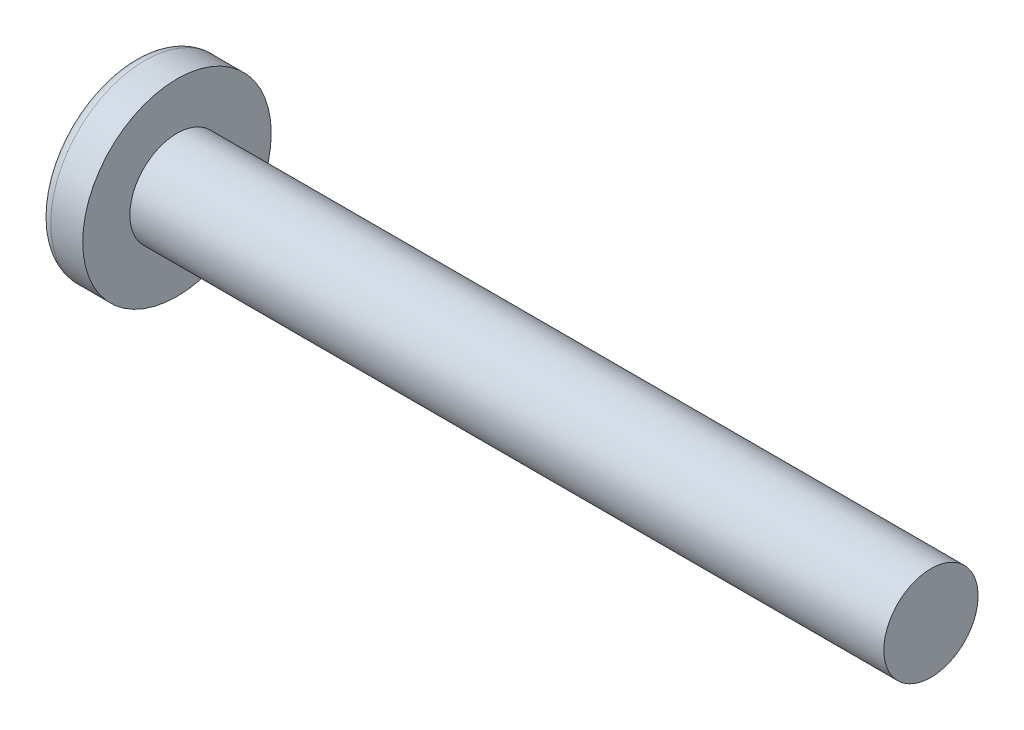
SolidWorks part; units mm, degrees
ref_plane "Plane1" through (0, 0, 0) normal (0, 0, 1) x (1, 0, 0)
ref_plane "Plane2" through (0, 0, 0) normal (0, 1, 0) x (1, 0, 0)
ref_plane "Plane3" through (0, 0, 0) normal (1, 0, 0) x (0, 0, -1)
revolve "Base-Revolve" add sketch "BodySke" angle 360 about L2
sketch "BodySke" plane through (0, 0, 0) normal (0, 0, 1) x (1, 0, 0)
  line L0 (7.5, 5) -> (7.5, 10)
  line L1 (9, 6.35) -> (9, -3.175) construction
  line L2 (-25.4, 0) -> (127, 0) construction
  line L3 (87.5, 0) -> (0, 0)
  line L4 (7.5, 5) -> (87.5, 5)
  line L5 (87.5, 5) -> (87.5, 0)
  line L6 (4.1004, 10) -> (7.5, 10)
  line L7 (7.5, -5) -> (87.5, -5) construction
  line L8 (49.5, 6.35) -> (49.5, -3.175) construction
  arc A0 (3.1356, 9.5135) -> (0, 0) centre (16, 0) ccw
  arc A2 (3.1356, 9.5135) -> (4.1004, 10) centre (4.1004, 8.8) cw
  dimension "Head_fillet_rad" = 1.2
  dimension "Head_crown_rad" = 16
  dimension "Head_ht" = 7.5
  dimension "Diameter" = 10
  dimension "Length" = 80
  dimension "Head_dia" = 20
  dimension "Advance" = 1.5
  dimension "Thread_nom" = 38
sketch "Sketch3" plane through (0, 0, 0) normal (1, 0, 0) x (0, 0, -1)
  line L0 (0.92, -5.09) -> (-0.92, -5.09)
  line L1 (0.92, -5.09) -> (0.92, 5.09)
  line L2 (-0.92, 5.09) -> (0.92, 5.09)
  line L3 (-0.92, 5.09) -> (-0.92, -5.09)
  dimension "D1" = 5.09
  dimension "Cross_dia" = 10.18
  dimension "D2" = 0.92
  dimension "Cross_width" = 1.84
ref_plane "Plane4" through (6.09, 0, 0) normal (1, 0, 0) x (0, 0, -1)
sketch "Sketch4" plane through (6.09, 0, 0) normal (1, 0, 0) x (0, 0, -1)
  line L0 (0.46, -0.46) -> (-0.46, -0.46)
  line L1 (0.46, -0.46) -> (0.46, 0.46)
  line L2 (-0.46, 0.46) -> (0.46, 0.46)
  line L3 (-0.46, 0.46) -> (-0.46, -0.46)
  dimension "D1" = 0.92
  dimension "D2" = 0.92
  dimension "D3" = 0.46
  dimension "D4" = 0.46
loft "Cut-Loft1" cut profiles "Sketch3", "Sketch4"
pattern_circular "CirPattern1" count 2 every 90 about axis through (0, 0, 0) along (1, 0, 0) of "Cut-Loft1"
sketch "ThdSchSke" plane through (0, 0, 0) normal (0, 0, 1) x (1, 0, 0)
  line L0 (49.5, -4.172) -> (48.9202, -5)
  line L1 (49.5, -4.172) -> (50.0798, -5)
  line L2 (50.0798, -5) -> (50.0798, -6.25)
  line L3 (-3.175, 0) -> (5.1513, 0) construction
  line L5 (50.0798, -6.25) -> (48.9202, -6.25)
  line L6 (48.9202, -6.25) -> (48.9202, -5)
  dimension "Thread_minor" = 8.344
  dimension "Diameter" = 10
  dimension "Start" = 49.5
  dimension "SideAngle" = 55
  dimension "VeeAngle" = 70
  dimension "Overcut" = 12.5
revolve "ThreadSchematic" [suppressed] cut sketch "ThdSchSke" angle 360 about L3
pattern_linear "ThdSchPat" [suppressed]
equation "\"D1@Sketch3\" = \"Cross_dia@Sketch3\" / 2"
equation "\"D2@Sketch3\" = \"Cross_width@Sketch3\" / 2"
equation "\"D1@Sketch4\" = \"Cross_width@Sketch3\" *.5"
equation "\"D2@Sketch4\" = \"D1@Sketch4\""
equation "\"D3@Sketch4\" = \"D1@Sketch4\" / 2"
equation "\"D4@Sketch4\" = \"D2@Sketch4\" / 2"
equation "\"Thread_length@ThreadCosmetic\" = ((sgn( (\"Length@BodySke\" - \"Advance@BodySke\" ) - \"Thread_nom@BodySke\" )-1)*( (\"Length@BodySke\" - \"Advance@BodySke\" ) - \"Thread_nom@BodySke\" ))/-2+ \"Thread_nom@BodySke\""
equation "\"Thread_minor@ThdSchSke\" = \"Thread_minor@ThreadCosmetic\""
equation "\"Diameter@ThdSchSke\" = \"Diameter@BodySke\""
equation "\"Overcut@ThdSchSke\" = \"Diameter@BodySke\" * 1.25"
equation "\"Start@ThdSchSke\" = \"Head_ht@BodySke\" + \"Length@BodySke\" - \"Thread_length@ThreadCosmetic\"  '---Non-countersunk---"
equation "\"Num_threads@ThdSchPat\" = int( \"Thread_length@ThreadCosmetic\" / \"Advance@BodySke\" + 0.999 )  + 1"
equation "\"Advance@ThdSchPat\" = \"Thread_length@ThreadCosmetic\" /  (\"Num_threads@ThdSchPat\" - 1) 'relax it"
